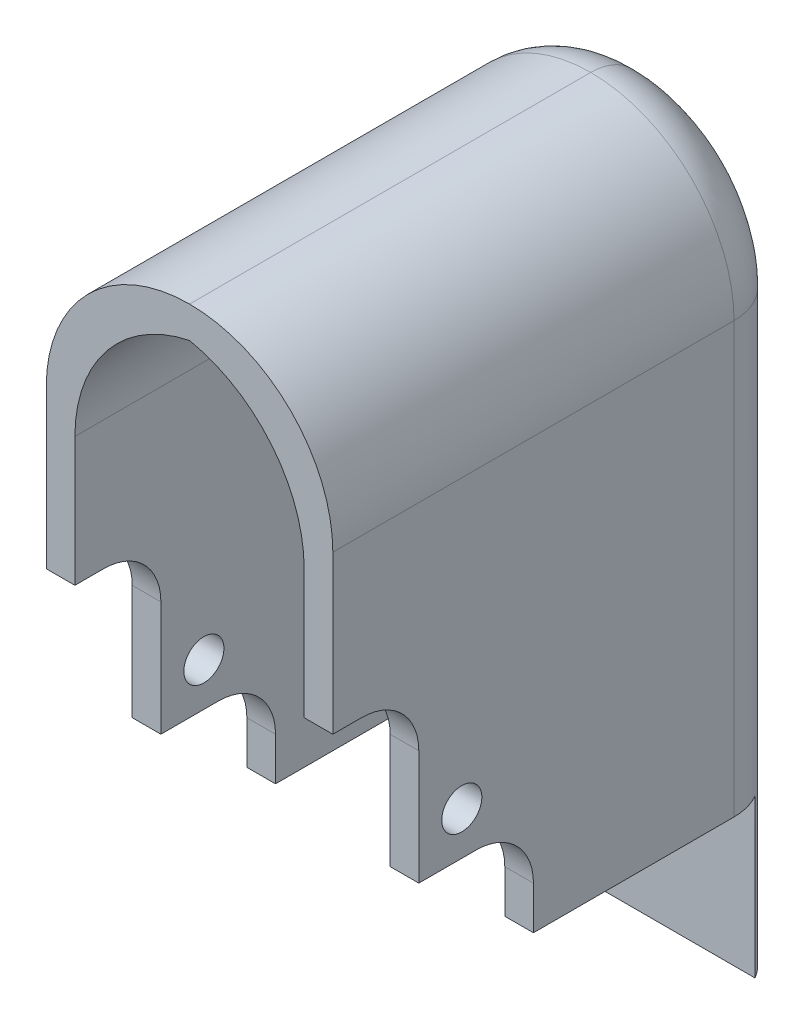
SolidWorks part; units mm, degrees
ref_plane "Front Plane" through (0, 0, 0) normal (0, 0, 1) x (1, 0, 0)
ref_plane "Top Plane" through (0, 0, 0) normal (0, 1, 0) x (1, 0, 0)
ref_plane "Right Plane" through (0, 0, 0) normal (1, 0, 0) x (0, 0, -1)
sketch "Sketch1" plane through (0, 0, 0) normal (0, 0, 1) x (1, 0, 0)
  line L1 (0, 0) -> (8, 0)
  line L2 (0, 0) -> (0, 23.5)
  line L3 (0, 23.5) -> (8, 23.5)
  line L4 (8, 0) -> (8, 23.5)
  line L5 (-1, 24.5) -> (9, 24.5)
  line L6 (-1, 24.5) -> (-1, -1)
  line L7 (-1, -1) -> (9, -1)
  line L8 (9, 24.5) -> (9, -1)
  dimension "D1" = 8
  dimension "D2" = 23.5
  dimension "D3" = 1
  dimension "D4" = 1
  dimension "D5" = 1
  dimension "D6" = 1
extrude "Boss-Extrude1" add sketch "Sketch1" against normal blind 1
sketch "Sketch2" plane through (0, 0, 0) normal (0, 0, 1) x (1, 0, 0)
  line L0 (9, -1) -> (9, 24.5) construction
  line L1 (8, 0) -> (8, 23.5) construction
  line L2 (8, 23.5) -> (0, 23.5) construction
  line L3 (9, 24.5) -> (-1, 24.5) construction
  line L4 (0, 23.5) -> (0, 0) construction
  line L5 (-1, 24.5) -> (-1, -1) construction
  line L6 (9, 0) -> (9, 24.5)
  line L7 (8, 0) -> (8, 23.5)
  line L8 (8, 23.5) -> (0, 23.5)
  line L9 (9, 24.5) -> (-1, 24.5)
  line L10 (0, 23.5) -> (0, 0)
  line L11 (-1, 24.5) -> (-1, 0)
  line L12 (0, 0) -> (-1, 0)
  line L13 (8, 0) -> (9, 0)
extrude "Boss-Extrude2" add sketch "Sketch2" along normal blind 15
sketch "Sketch3" plane through (0, 0, 15) normal (0, 0, 1) x (1, 0, 0)
  line L0 (0, 0) -> (0, 23.5) construction
  line L1 (-1, 0) -> (0, 0)
  line L2 (-1, 0) -> (-1, 14)
  line L3 (-1, 14) -> (0, 14)
  line L4 (0, 0) -> (0, 14)
  line L5 (4, 23.5) -> (4, 0) construction
  line L6 (0, 23.5) -> (8, 23.5) construction
  line L7 (0, 0) -> (8, 0) construction
  line L8 (9, 0) -> (8, 0)
  line L9 (9, 0) -> (9, 14)
  line L10 (9, 14) -> (8, 14)
  line L11 (8, 0) -> (8, 14)
  dimension "D1" = 14
extrude "Cut-Extrude1" cut sketch "Sketch3" against normal blind 3
sketch "Sketch4" plane through (0, 0, 12) normal (0, 0, 1) x (1, 0, 0)
  line L0 (0, 0) -> (0, 14) construction
  line L1 (-1, 0) -> (0, 0)
  line L2 (-1, 0) -> (-1, 8)
  line L3 (-1, 8) -> (0, 8)
  line L4 (0, 0) -> (0, 8)
  line L5 (4, 23.5) -> (4, 0) construction
  line L6 (0, 23.5) -> (8, 23.5) construction
  line L7 (0, 0) -> (8, 0) construction
  line L8 (9, 0) -> (8, 0)
  line L9 (8, 0) -> (8, 8)
  line L10 (9, 0) -> (9, 8)
  line L11 (9, 8) -> (8, 8)
  dimension "D1" = 8
extrude "Cut-Extrude2" cut sketch "Sketch4" against normal blind 4
fillet "Fillet1" radius 2 4 edges at (8.5, 8, 8) (8.5, 14, 12) (-0.5, 14, 12) (-0.5, 8, 8)
sketch "Sketch5" plane through (0, 0, 0) normal (0, 1, 0) x (1, 0, 0)
  line L4 (0, 0) -> (8, 0)
  line L5 (8, 0) -> (8, 1)
  line L6 (8, 1) -> (0, 1)
  line L7 (0, 1) -> (0, 0)
  line L8 (0, 0) -> (8, 0)
  line L9 (8, 0) -> (8, 1)
  line L10 (8, 1) -> (0, 1)
  line L11 (0, 1) -> (0, 0)
  dimension "D1" = 0
extrude "Boss-Extrude3" add sketch "Sketch5" along normal blind 23.5
sketch "Sketch6" plane through (9, 0, 0) normal (1, 0, 0) x (0, 0, -1)
  line L0 (-12, 8) -> (-12, 12) construction
  line L1 (-10, 8) -> (-12, 8) construction
  circle A0 centre (-10.5, 9.5) radius 0.7
  dimension "D1" = 1.4
  dimension "D2" = 1.5
  dimension "D3" = 1.5
extrude "Cut-Extrude3" cut sketch "Sketch6" against normal through all
sketch "Sketch7" plane through (0, 0, 8) normal (0, 0, 1) x (1, 0, 0)
  line L0 (0, 0) -> (0, 6) construction
  line L1 (-1, 0) -> (0, 0)
  line L2 (-1, 0) -> (-1, 4.5)
  line L3 (-1, 4.5) -> (0, 4.5)
  line L4 (0, 0) -> (0, 4.5)
  line L5 (4, -0.6505) -> (4, 23.5) construction
  line L6 (0, 23.5) -> (8, 23.5) construction
  line L7 (9, 0) -> (8, 0)
  line L8 (8, 0) -> (8, 4.5)
  line L9 (9, 0) -> (9, 4.5)
  line L10 (9, 4.5) -> (8, 4.5)
  dimension "D1" = 4.5
extrude "Cut-Extrude4" cut sketch "Sketch7" against normal blind 8
fillet "Fillet2" radius 5 4 edges at (0, 23.5, 7.5) (8, 23.5, 7.5) (-1, 24.5, 7) (9, 24.5, 7)
fillet "Fillet3" radius 2 4 edges at (-1, 9.25, -1) (9, 9.25, -1) (7.5355, 23.0355, -1) (0.4645, 23.0355, -1)
